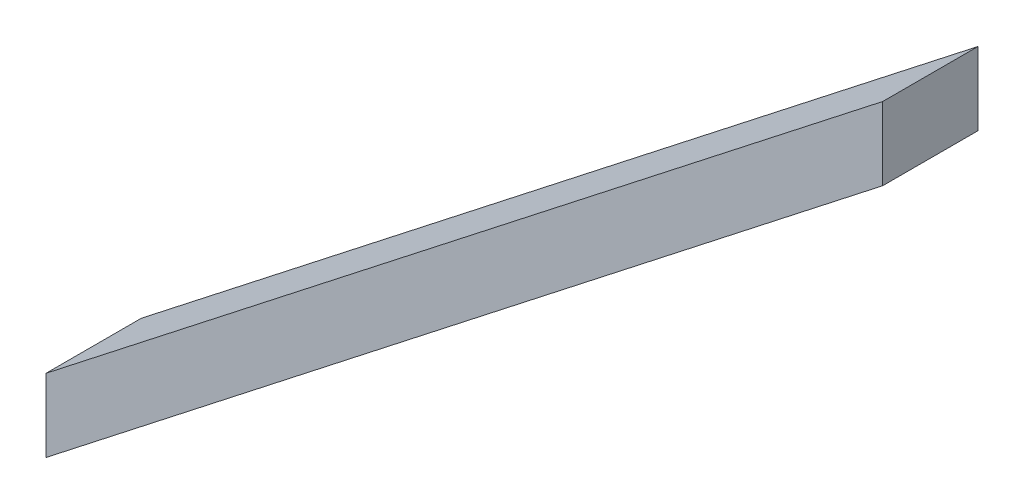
SolidWorks part; units mm, degrees
ref_plane "Front Plane" through (0, 0, 0) normal (0, 0, 1) x (1, 0, 0)
ref_plane "Top Plane" through (0, 0, 0) normal (0, 1, 0) x (1, 0, 0)
ref_plane "Right Plane" through (0, 0, 0) normal (1, 0, 0) x (0, 0, -1)
sketch "Sketch1" plane through (0, 0, 0) normal (0, 0, 1) x (1, 0, 0)
  line L0 (0, 0) -> (0, 48.2227)
  line L1 (0, 48.2227) -> (553, 480.2736)
  line L2 (553, 480.2736) -> (553, 432.051)
  line L3 (553, 432.051) -> (0, 0)
  line L4 (553, -960.5473) -> (553, 483.4527) construction
  dimension "D1" = 38
  dimension "D2" = 52
extrude "Boss-Extrude1" add sketch "Sketch1" along normal blind 63 contours L1 L2 L3 L0
